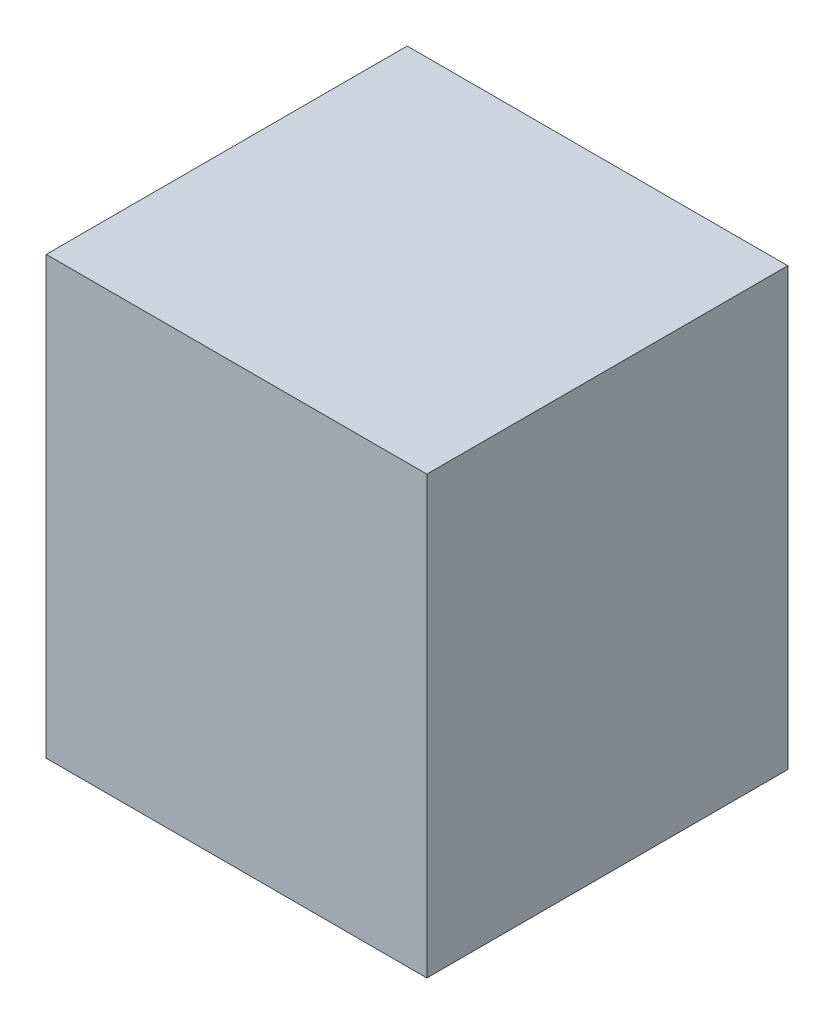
SolidWorks part; units mm, degrees
ref_plane "Front Plane" through (0, 0, 0) normal (0, 0, 1) x (1, 0, 0)
ref_plane "Top Plane" through (0, 0, 0) normal (0, 1, 0) x (1, 0, 0)
ref_plane "Right Plane" through (0, 0, 0) normal (1, 0, 0) x (0, 0, -1)
sketch "Sketch1" plane through (0, 0, 0) normal (0, 1, 0) x (1, 0, 0)
  line L1 (-84.8514, 80.4625) -> (84.8514, 80.4625)
  line L2 (-84.8514, 80.4625) -> (-84.8514, -80.4625)
  line L3 (-84.8514, -80.4625) -> (84.8514, -80.4625)
  line L4 (84.8514, 80.4625) -> (84.8514, -80.4625)
  line L5 (-84.8514, 80.4625) -> (84.8514, -80.4625) construction
  line L6 (-84.8514, -80.4625) -> (84.8514, 80.4625) construction
  point P0 (0, 0)
extrude "Boss-Extrude1" add sketch "Sketch1" along normal blind 194.564
